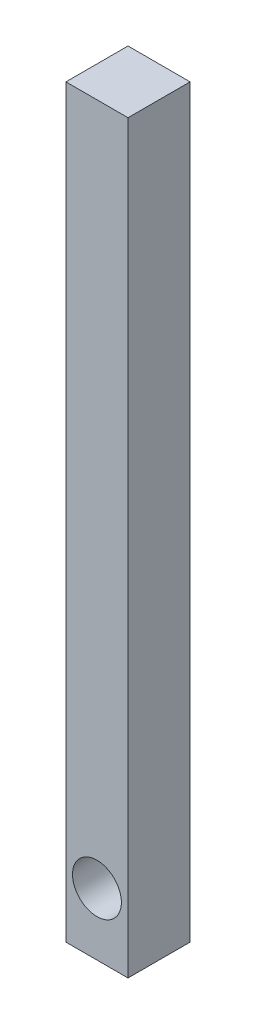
SolidWorks part; units mm, degrees
ref_plane "Front Plane" through (0, 0, 0) normal (0, 0, 1) x (1, 0, 0)
ref_plane "Top Plane" through (0, 0, 0) normal (0, 1, 0) x (1, 0, 0)
ref_plane "Right Plane" through (0, 0, 0) normal (1, 0, 0) x (0, 0, -1)
sketch "Sketch1" plane through (0, 0, 0) normal (0, 0, 1) x (1, 0, 0)
  line L1 (0, 0) -> (-6.35, 0)
  line L2 (0, 0) -> (0, 76.2)
  line L3 (0, 76.2) -> (-6.35, 76.2)
  line L4 (-6.35, 0) -> (-6.35, 76.2)
  dimension "D1" = 6.35
  dimension "D2" = 76.2
extrude "Boss-Extrude1" add sketch "Sketch1" along normal blind 6.35
sketch "Sketch2" plane through (0, 0, 6.35) normal (0, 0, 1) x (1, 0, 0)
  line L0 (-6.35, 0) -> (0, 0) construction
  circle A0 centre (-3.175, 6.35) radius 2.5
  point P4 (-3.175, 0)
  dimension "D1" = 5
  dimension "D2" = 6.35
extrude "Cut-Extrude1" cut sketch "Sketch2" against normal through all contours A0
